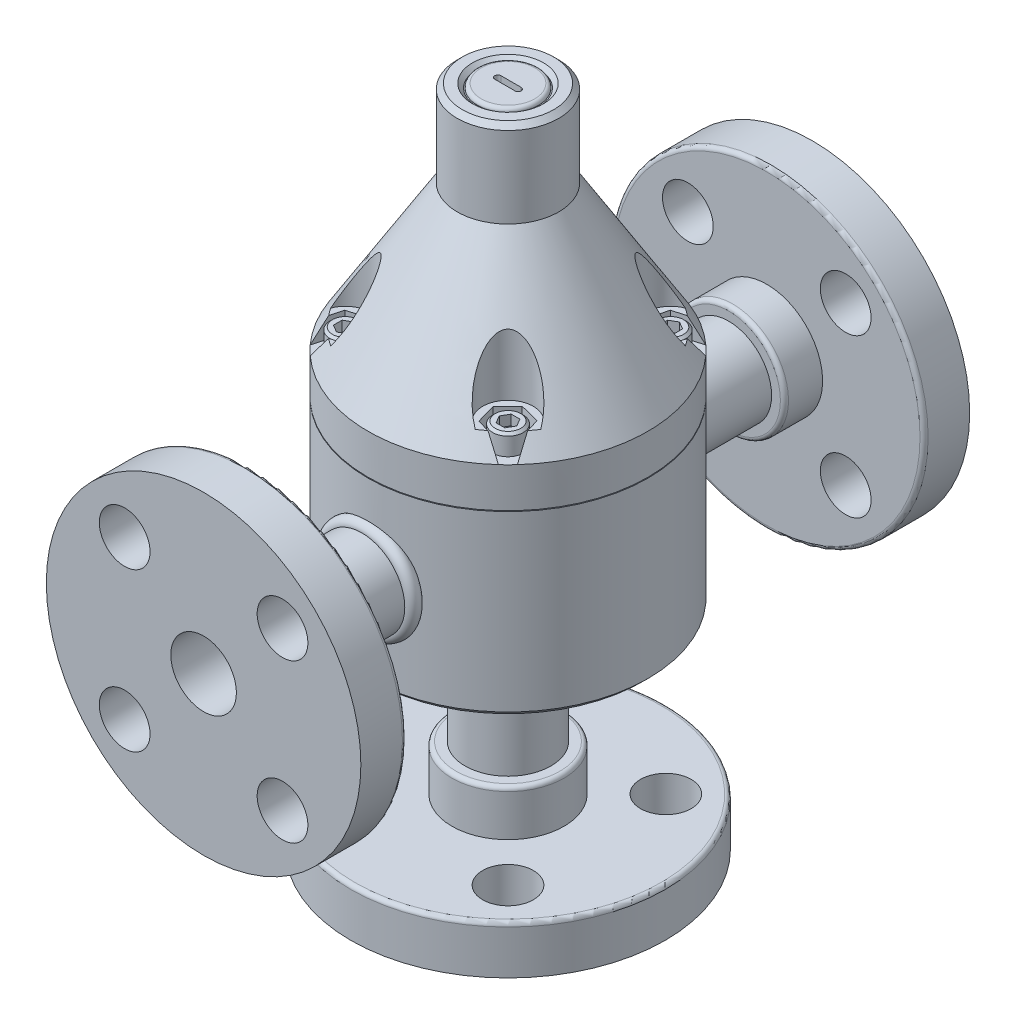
SolidWorks part; units mm, degrees
ref_plane "Front Plane" through (0, 0, 0) normal (0, 0, 1) x (1, 0, 0)
ref_plane "Top Plane" through (0, 0, 0) normal (0, 1, 0) x (1, 0, 0)
ref_plane "Right Plane" through (0, 0, 0) normal (1, 0, 0) x (0, 0, -1)
sketch "Sketch1" plane through (0, 0, 0) normal (0, 1, 0) x (1, 0, 0)
  circle A0 centre (0, 0) radius 43.815
  dimension "D1" = 87.63
extrude "Extrude1" add sketch "Sketch1" along normal blind 140.97
sketch "Sketch2" plane through (0, 0, 0) normal (0, 0, 1) x (1, 0, 0)
  line L0 (0, 0) -> (0, 140.97) construction
  line L1 (43.815, 140.97) -> (-43.815, 140.97) construction
  line L2 (-43.815, 56.134) -> (-43.815, 68.58)
  line L3 (-43.815, 56.134) -> (-30.226, 56.134)
  line L4 (-30.226, 56.134) -> (-30.226, 55.88)
  line L6 (-30.226, 55.88) -> (-49.4473, 55.88)
  line L7 (-49.4473, 55.88) -> (-49.4473, 147.034)
  line L8 (-49.4473, 147.034) -> (-15.875, 147.034)
  line L9 (-15.875, 147.034) -> (-15.875, 114.046)
  line L10 (-15.875, 114.046) -> (-43.815, 68.58)
  line L12 (-43.815, 0) -> (43.815, 0) construction
  dimension "D1" = 43.815
  dimension "D2" = 55.88
  dimension "D3" = 0.254
  dimension "D4" = 30.226
  dimension "D5" = 15.875
  dimension "D6" = 68.58
  dimension "D7" = 26.924
revolve "Cut-Revolve1" cut sketch "Sketch2" angle 360 about L0
ref_plane "Plane1" through (0, 140.97, 0) normal (0, 1, 0) x (-1, 0, 0)
sketch "Sketch3" plane through (0, 140.97, 0) normal (0, 1, 0) x (-1, 0, 0)
  circle A0 centre (0, 0) radius 11.1125
  dimension "D1" = 22.225
extrude "Extrude2" cut sketch "Sketch3" against normal blind 1.27 draft 45
chamfer "Chamfer1" distance 1.5748 angle 45 2 edges at (0, 0, 43.815) (0, 140.97, 15.875)
sketch "Sketch4" plane through (0, 140.97, 0) normal (0, 1, 0) x (-1, 0, 0)
  circle A0 centre (0, 0) radius 9.525
  dimension "D1" = 19.05
extrude "Extrude3" add sketch "Sketch4" against normal up to surface (1.27 mm away)
fillet "Fillet1" radius 1.143 1 edges at (0, 140.97, 9.525)
sketch "Sketch5" plane through (0, 140.97, 0) normal (0, 1, 0) x (-1, 0, 0)
  line L0 (-3.175, 0) -> (3.175, 0) construction
  line L1 (3.175, 0.9652) -> (-3.175, 0.9652)
  line L2 (-3.175, -0.9652) -> (3.175, -0.9652)
  arc A0 (-3.175, 0.9652) -> (-3.175, -0.9652) centre (-3.175, 0) ccw
  arc A1 (3.175, -0.9652) -> (3.175, 0.9652) centre (3.175, 0) ccw
  dimension "D1" = 3.175
  dimension "D2" = 6.35
  dimension "D3" = 0.9652
  dimension "D4" = 0.9652
extrude "Extrude4" cut sketch "Sketch5" against normal blind 3.302 draft 1
ref_plane "Plane2" through (0, 74.93, 0) normal (0, 1, 0) x (-1, 0, 0)
sketch "Sketch6" plane through (0, 74.93, 0) normal (0, 1, 0) x (-1, 0, 0)
  line L0 (0, 0) -> (-43.815, 0) construction
  line L1 (0, 0) -> (-30.9819, 30.9819) construction
  circle A0 centre (0, 0) radius 43.815 construction
  circle A1 centre (0, 0) radius 36.0045 construction
  circle A2 centre (-25.459, 25.459) radius 7.9375
  dimension "D1" = 72.009
  dimension "D2" = 15.875
extrude "Extrude5" cut sketch "Sketch6" along normal blind 22.86
sketch "Sketch8" plane through (0, 74.93, 0) normal (0, 1, 0) x (-1, 0, 0)
  line L0 (0, 0) -> (-30.9819, 30.9819) construction
  line L1 (-30.9819, 19.758) -> (-19.9362, 31.1601) construction
  line L2 (-30.9819, 30.9819) -> (-39.3973, 39.3973) construction
  line L3 (-29.9486, 20.8246) -> (-23.6903, 19.2537)
  line L4 (-23.6903, 19.2537) -> (-19.2007, 23.8882)
  line L5 (-19.2007, 23.8882) -> (-20.9694, 30.0935)
  line L9 (-29.9486, 20.8246) -> (-33.5917, 33.5917)
  line L10 (-33.5917, 33.5917) -> (-20.9694, 30.0935)
  line L12 (-27.2278, 31.6643) -> (-31.7174, 27.0299)
  line L13 (-20.9694, 30.0935) -> (-27.2278, 31.6643)
  line L14 (-31.7174, 27.0299) -> (-29.9486, 20.8246)
  circle A0 centre (0, 0) radius 43.815 construction
  arc A1 (-32.876, 22.6318) -> (-22.6318, 32.876) centre (-25.459, 25.459) ccw construction
  arc A2 (-32.876, 22.6318) -> (-22.6318, 32.876) centre (-25.459, 25.459) ccw construction
  circle A3 centre (-25.459, 25.459) radius 5.588 construction
extrude "Extrude6" cut sketch "Sketch8" against normal blind 6.35
pattern_circular "CirPattern1" count 4 over 360 about axis through (0, 0, 0) along (0, 1, 0) of "Extrude5", "Extrude6"
sketch "Sketch9" plane through (0, 74.93, 0) normal (0, 1, 0) x (-1, 0, 0)
  line L0 (0, 0) -> (-25.459, 25.459) construction
  circle A0 centre (-25.459, 25.459) radius 4.7625
  dimension "D1" = 9.525
extrude "Extrude7" add sketch "Sketch9" against normal up to surface (6.35 mm away)
sketch "Sketch10" plane through (0, 74.93, 0) normal (0, 1, 0) x (-1, 0, 0)
  line L1 (-28.1871, 25.459) -> (-26.8231, 23.0964)
  line L2 (-26.8231, 23.0964) -> (-24.095, 23.0964)
  line L3 (-24.095, 23.0964) -> (-22.7309, 25.459)
  line L4 (-22.7309, 25.459) -> (-24.095, 27.8216)
  line L5 (-24.095, 27.8216) -> (-26.8231, 27.8216)
  line L6 (-26.8231, 27.8216) -> (-28.1871, 25.459)
  circle A0 centre (-25.459, 25.459) radius 2.3626 construction
extrude "Extrude8" cut sketch "Sketch10" against normal blind 3.175
pattern_circular "CirPattern2" count 4 over 360 about axis through (0, 0, 0) along (0, 1, 0) of "Extrude7", "Extrude8"
chamfer "Chamfer2" distance 0.762 angle 45 4 edges at (-25.459, 74.93, -30.2215) (30.2215, 74.93, -25.459) (25.459, 74.93, 30.2215) (-30.2215, 74.93, 25.459)
ref_plane "Plane3" through (0, 0, 95.25) normal (0, 0, 1) x (1, 0, 0)
sketch "Sketch11" plane through (0, 0, 95.25) normal (0, 0, 1) x (1, 0, 0)
  line L0 (0, 0) -> (0, 140.97) construction
  line L1 (14.3002, 140.97) -> (-14.3002, 140.97) construction
  line L2 (-43.815, 28.575) -> (43.815, 28.575) construction
  line L3 (-43.815, 55.88) -> (-43.815, 1.5748) construction
  line L4 (43.815, 1.5748) -> (43.815, 55.88) construction
  line L5 (-42.2402, 0) -> (42.2402, 0) construction
  circle A0 centre (0, 28.575) radius 49.2125
  dimension "D2" = 98.425
  dimension "D1" = 28.575
extrude "Boss-Extrude1" add sketch "Sketch11" against normal blind 14.2748 separate body
sketch "Sketch12" plane through (0, 0, 95.25) normal (0, 0, 1) x (1, 0, 0)
  circle A0 centre (0, 28.575) radius 17.4625
  dimension "D1" = 34.925
extrude "Boss-Extrude2" add sketch "Sketch12" against normal blind 26.2128
sketch "Sketch13" plane through (0, 0, 95.25) normal (0, 0, 1) x (1, 0, 0)
  circle A0 centre (0, 28.575) radius 13.4366
  dimension "D1" = 26.8732
extrude "Boss-Extrude3" add sketch "Sketch13" against normal up to surface (53.5461 mm away)
sketch "Sketch14" plane through (0, 0, 95.25) normal (0, 0, 1) x (1, 0, 0)
  circle A0 centre (0, 28.575) radius 10.2616
  dimension "D1" = 20.5232
extrude "Cut-Extrude1" cut sketch "Sketch14" against normal blind 25.4
sketch "Sketch15" plane through (0, 0, 95.25) normal (0, 0, 1) x (1, 0, 0)
  line L0 (0, 28.575) -> (-49.2125, 28.575) construction
  line L1 (0, 28.575) -> (-34.7985, 63.3735) construction
  circle A0 centre (0, 28.575) radius 49.2125 construction
  circle A1 centre (0, 28.575) radius 34.925 construction
  circle A2 centre (-24.6957, 53.2707) radius 7.9375
  dimension "D2" = 69.85
  dimension "D3" = 15.875
  dimension "D1" = 45
extrude "Cut-Extrude2" cut sketch "Sketch15" against normal blind 25.4
pattern_circular "CirPattern3" count 4 over 360 about axis through (0, 28.575, 0) along (0, 0, 1) of "Cut-Extrude2"
sketch "Sketch16" plane through (0, 0, 0) normal (1, 0, 0) x (0, 0, -1)
  line L0 (-41.2557, 38.1023) -> (-45.7371, 38.1023)
  line L1 (-45.7371, 38.1023) -> (-45.7371, 42.0116)
  line L2 (-43.815, 42.0116) -> (-69.0372, 42.0116) construction
  line L3 (-41.2557, 38.1023) -> (-41.2557, 42.4601)
  line L4 (-95.25, 28.575) -> (0, 28.575) construction
  line L5 (-95.25, 77.7875) -> (-95.25, -20.6375) construction
  arc A0 (-45.7371, 42.0116) -> (-41.2557, 42.4601) centre (-43.4739, 42.0116) cw
revolve "Revolve1" add sketch "Sketch16" angle 360 about L4
ref_plane "Plane4" through (0, 0, -95.25) normal (0, 0, 1) x (1, 0, 0)
sketch "Sketch18" plane through (0, 0, -95.25) normal (0, 0, 1) x (1, 0, 0)
  circle A0 centre (0, 28.575) radius 49.2125
  dimension "D1" = 98.425
extrude "Boss-Extrude5" add sketch "Sketch18" along normal blind 14.2748 separate body
sketch "Sketch19" plane through (0, 0, -95.25) normal (0, 0, 1) x (1, 0, 0)
  circle A0 centre (0, 28.575) radius 17.4625
  dimension "D1" = 34.925
extrude "Boss-Extrude6" add sketch "Sketch19" along normal blind 26.2128
sketch "Sketch20" plane through (0, 0, -95.25) normal (0, 0, 1) x (1, 0, 0)
  circle A0 centre (0, 28.575) radius 13.4366
  dimension "D1" = 26.8732
extrude "Boss-Extrude7" add sketch "Sketch20" along normal up to surface (53.5461 mm away)
sketch "Sketch21" plane through (0, 0, -95.25) normal (0, 0, 1) x (1, 0, 0)
  circle A0 centre (0, 28.575) radius 10.2616
  dimension "D1" = 20.5232
extrude "Cut-Extrude3" cut sketch "Sketch21" along normal blind 25.4
sketch "Sketch22" plane through (0, 0, -95.25) normal (0, 0, 1) x (1, 0, 0)
  circle A0 centre (24.6957, 53.2707) radius 7.9375
extrude "Cut-Extrude4" cut sketch "Sketch22" along normal blind 25.4
pattern_circular "CirPattern4" count 4 over 360 about axis through (0, 28.575, 0) along (0, 0, 1) of "Cut-Extrude4"
fillet "Fillet3" radius 1.27 4 edges at (49.2125, 28.575, -80.9752) (17.4625, 28.575, -69.0372) (17.4625, 28.575, 69.0372) (49.2125, 28.575, 80.9752)
mirror "Mirror1" about plane through (0, 0, 0) normal (0, 0, 1) of "Revolve1"
ref_plane "Plane5" through (0, -66.675, 0) normal (0, 1, 0) x (1, 0, 0)
sketch "Sketch23" plane through (0, -66.675, 0) normal (0, 1, 0) x (1, 0, 0)
  circle A0 centre (0, 0) radius 49.2125
  dimension "D1" = 98.425
extrude "Boss-Extrude8" add sketch "Sketch23" along normal blind 15.0622 separate body
sketch "Sketch24" plane through (0, -66.675, 0) normal (0, 1, 0) x (1, 0, 0)
  circle A0 centre (0, 0) radius 17.526
  dimension "D1" = 35.052
extrude "Boss-Extrude9" add sketch "Sketch24" along normal blind 29.3624
sketch "Sketch25" plane through (0, -66.675, 0) normal (0, 1, 0) x (1, 0, 0)
  circle A0 centre (0, 0) radius 13.4366
  dimension "D1" = 26.8732
extrude "Boss-Extrude10" add sketch "Sketch25" along normal up to surface (66.675 mm away)
sketch "Sketch26" plane through (0, -66.675, 0) normal (0, 1, 0) x (1, 0, 0)
  circle A0 centre (0, 0) radius 10.2616
  dimension "D1" = 20.5232
extrude "Cut-Extrude5" cut sketch "Sketch26" along normal blind 25.4
fillet "Fillet4" radius 1.27 2 edges at (0, -51.6128, 49.2125) (0, -37.3126, 17.526)
sketch "Sketch27" plane through (0, -66.675, 0) normal (0, 1, 0) x (1, 0, 0)
  line L0 (0, 0) -> (-49.2125, 0) construction
  line L1 (0, 0) -> (-34.7985, -34.7985) construction
  circle A0 centre (0, 0) radius 49.2125 construction
  circle A1 centre (0, 0) radius 34.925 construction
  circle A2 centre (-24.6957, -24.6957) radius 7.9375
  dimension "D2" = 69.85
  dimension "D3" = 15.875
  dimension "D1" = 45
extrude "Cut-Extrude6" cut sketch "Sketch27" along normal blind 25.4
pattern_circular "CirPattern5" count 4 over 360 about axis through (0, 0, 0) along (0, 1, 0) of "Cut-Extrude6"
sketch "Sketch28" plane through (0, 0, 0) normal (1, 0, 0) x (0, 0, -1)
  line L0 (-16.6116, 0.846) -> (-16.6116, 3.7228)
  line L1 (-16.6116, 3.7228) -> (-10.335, 3.7228)
  line L2 (-10.335, 3.7228) -> (-10.335, -3.175)
  line L3 (-13.4366, 0) -> (-13.4366, -37.3126) construction
  line L4 (-42.2402, 0) -> (42.2402, 0) construction
  line L5 (0, 0) -> (0, -19.7765) construction
  arc A0 (-10.335, -3.175) -> (-16.6116, 0.846) centre (-12.0764, 1.0161) cw
  dimension "D1" = 3.175
  dimension "D3" = 3.175
revolve "Revolve2" add sketch "Sketch28" angle 360 about L5
